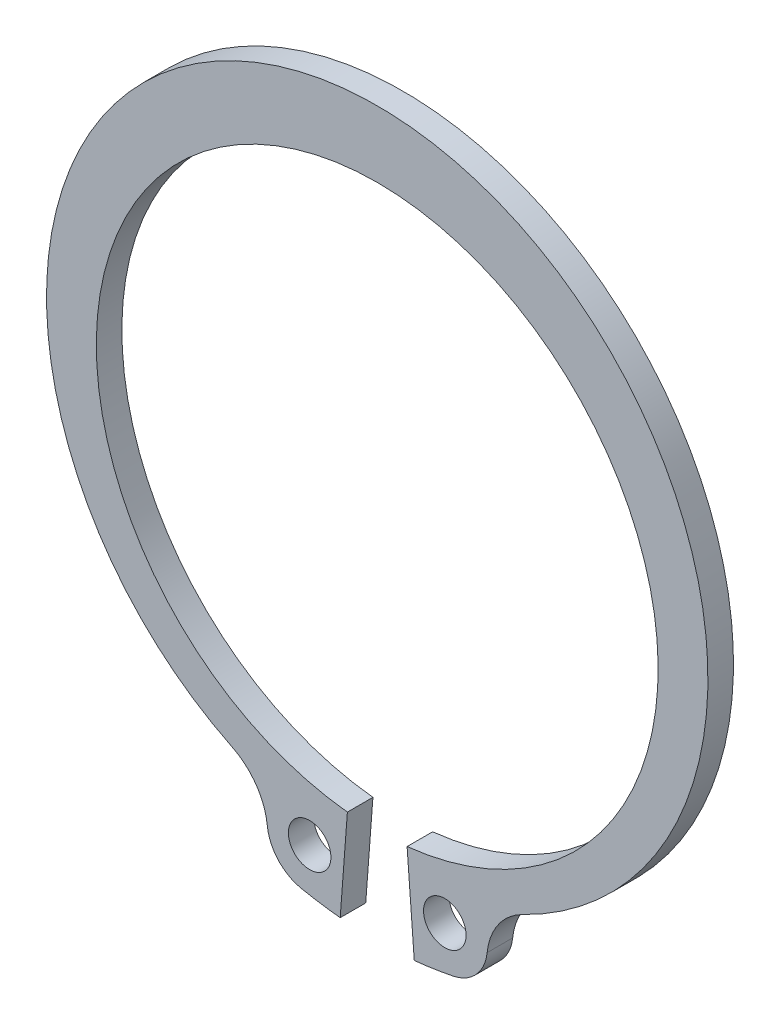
SolidWorks part; units mm, degrees
ref_plane "Face" through (0, 0, 0) normal (0, 0, 1) x (1, 0, 0)
ref_plane "Dessus" through (0, 0, 0) normal (0, 1, 0) x (1, 0, 0)
ref_plane "Droite" through (0, 0, 0) normal (1, 0, 0) x (0, 0, -1)
sketch "Esquisse1" plane through (0, 0, 0) normal (0, 0, 1) x (1, 0, 0)
  line L0 (0, 20.4) -> (0, 16.5) construction
  line L1 (1.7534, -16.4066) -> (2.1753, -21.9907)
  line L2 (-1.7534, -16.4066) -> (-2.1753, -21.9907)
  line L3 (0.5, -16.0922) -> (0.5, -21.6922) construction
  line L4 (-0.5, -16.0922) -> (-0.5, -21.6922) construction
  arc A0 (1.7534, -16.4066) -> (-1.7534, -16.4066) centre (0, 0) ccw
  arc A1 (8.5375, -16.4733) -> (-8.5375, -16.4733) centre (0, 0.975) ccw
  arc A2 (2.1753, -21.9907) -> (4.4759, -21.6399) centre (0, 0) ccw
  circle A3 centre (3.9695, -19.1918) radius 1.25
  arc A4 (4.4759, -21.6399) -> (6.456, -19.4517) centre (3.9695, -19.1918) ccw
  arc A5 (8.5375, -16.4733) -> (6.456, -19.4517) centre (10.1856, -19.8417) ccw
  circle A6 centre (-3.9695, -19.1918) radius 1.25
  arc A7 (-8.5375, -16.4733) -> (-6.456, -19.4517) centre (-10.1856, -19.8417) cw
  arc A8 (-4.4759, -21.6399) -> (-6.456, -19.4517) centre (-3.9695, -19.1918) cw
  arc A9 (-2.1753, -21.9907) -> (-4.4759, -21.6399) centre (0, 0) cw
  arc A10 (0.5, -16.0922) -> (-0.5, -16.0922) centre (0, 0) ccw construction
  circle A11 centre (0, 0) radius 17.5 construction
  dimension "dgorge" = 33
  dimension "D3" = 0.975
  dimension "dtrou" = 2.5
  dimension "D8" = 2.5
  dimension "D9" = 3.75
  dimension "dint" = 32.2
  dimension "dn" = 35
  dimension "b" = 3.9
  dimension "a" = 5.6
  dimension "D5" = 12.2
  dimension "D7" = 2
  dimension "D12" = 1
  dimension "D13" = 3.559
  dimension "D14" = 4.32
extrude "Base-Extrusion" add sketch "Esquisse1" along normal blind 1.5
equation "\"D3@Esquisse1\" = \"b@Esquisse1\"/4"
equation "\"D7@Esquisse1\"=\"dtrou@Esquisse1\"*0.8"
equation "\"D8@Esquisse1\" = \"dtrou@Esquisse1\""
equation "\"D9@Esquisse1\" = \"dtrou@Esquisse1\"*1.5"
equation "\"D12@Esquisse1\" = \"dtrou@Esquisse1\"*0.4"
equation "\"D5@Esquisse1\" = 360-(360-\"D13@Esquisse1\")*\"dint@Esquisse1\"/\"dgorge@Esquisse1\""
equation "\"D14@Esquisse1\" = (\"D5@Esquisse1\"-\"D13@Esquisse1\")/2"
